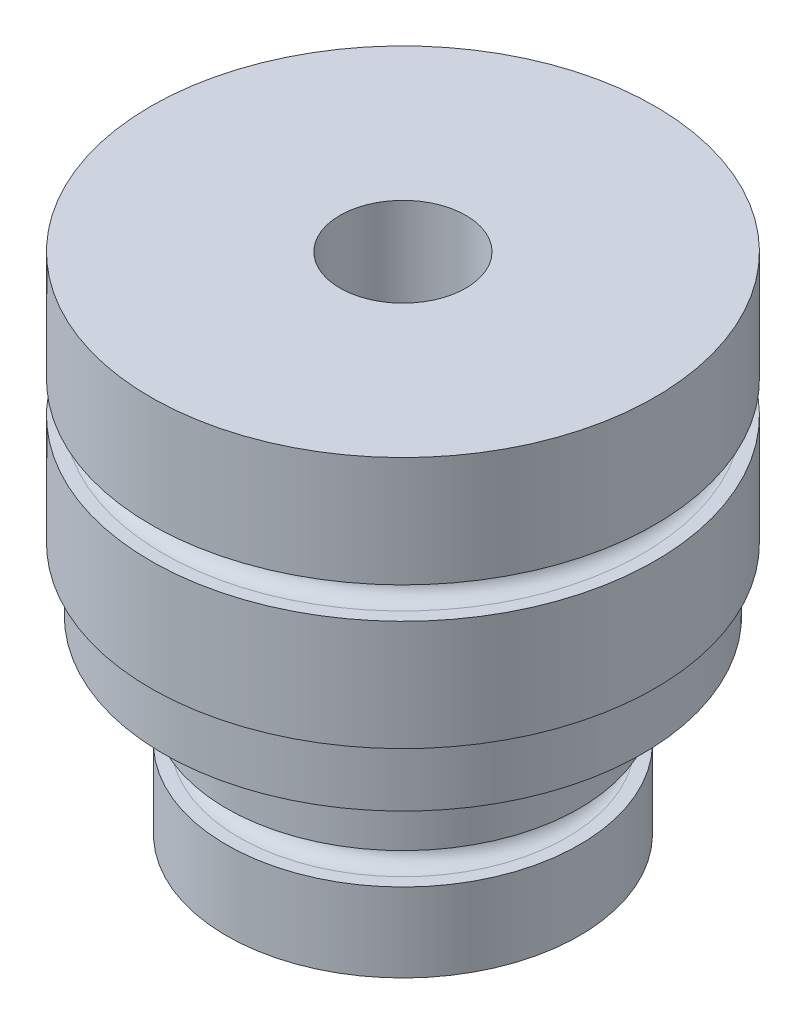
SolidWorks part; units mm, degrees
ref_plane "Front Plane" through (0, 0, 0) normal (0, 0, 1) x (1, 0, 0)
ref_plane "Top Plane" through (0, 0, 0) normal (0, 1, 0) x (1, 0, 0)
ref_plane "Right Plane" through (0, 0, 0) normal (1, 0, 0) x (0, 0, -1)
sketch "Sketch1" plane through (0, 0, 0) normal (0, 0, 1) x (1, 0, 0)
  line L0 (0, 0) -> (-15, 0)
  line L1 (-15, 0) -> (-15, -8.75)
  line L2 (-15, -20) -> (-14, -20)
  line L3 (-14, -20) -> (-14, -25)
  line L4 (-14, -25) -> (-9, -25)
  line L5 (-9, -25) -> (-9, -31.25)
  line L6 (-9, -40) -> (-2, -40)
  line L7 (0, -38) -> (0, 0)
  line L8 (5, 2.9586) -> (5, -39.4421) construction
  line L9 (-15, -8.75) -> (-14, -8.75)
  line L10 (-14, -11.25) -> (-15, -11.25)
  line L11 (-9, -31.25) -> (-8, -31.25)
  line L12 (-9, -33.75) -> (-8, -33.75)
  line L13 (-9, -33.75) -> (-9, -40)
  line L14 (-15, -11.25) -> (-15, -20)
  line L15 (-3.7593, -10) -> (0, -10) construction
  line L16 (8.5, -32.5) -> (0, -32.5) construction
  line L17 (0, -38) -> (-2, -40)
  arc A0 (-14, -8.75) -> (-14, -11.25) centre (-14, -10) cw
  arc A1 (-8, -33.75) -> (-8, -31.25) centre (-8, -32.5) ccw
  dimension "D7" = 1.25
  dimension "D9" = 1.25
  dimension "D2" = 15
  dimension "D3" = 5
  dimension "D4" = 5
  dimension "D5" = 20
  dimension "D6" = 10
  dimension "D8" = 1
  dimension "D10" = 1
  dimension "D11" = 40
  dimension "D12" = 14
  dimension "D13" = 7
  dimension "D14" = 45
revolve "Revolve1" add sketch "Sketch1" angle 360 about L8
sketch "Sketch2" plane through (0, 0, 0) normal (0, 0, 1) x (1, 0, 0)
  line L0 (24, -21.5) -> (7.5, -21.5)
  line L1 (24, -25) -> (24, -20) construction
  line L2 (8.5, -23.5) -> (8.5, -38.5)
  line L3 (8.5, -38.5) -> (10, -40)
  line L4 (-9, -40) -> (19, -40) construction
  line L5 (24, -21.5) -> (24, -23.5)
  line L6 (24, -23.5) -> (8.5, -23.5)
  line L7 (-14, -22.5) -> (24, -22.5) construction
  line L8 (-14, -20) -> (-14, -25) construction
  line L9 (7.5, -21.5) -> (7.5, -38.5)
  line L10 (7.5, -38.5) -> (9, -40)
  line L11 (9, -40) -> (10, -40)
  line L12 (5, 0) -> (5, -40) construction
  line L13 (25, 0) -> (-15, 0) construction
  line L14 (24, -22.5) -> (8, -22.5) construction
  line L15 (8, -22.5) -> (8, -39.8841) construction
  line L16 (8, -39.8841) -> (9.5, -40) construction
  dimension "D1" = 45
  dimension "D2" = 2
  dimension "D3" = 15
  dimension "D4" = 1
  dimension "D5" = 2.5
  dimension "D6" = 1.5
